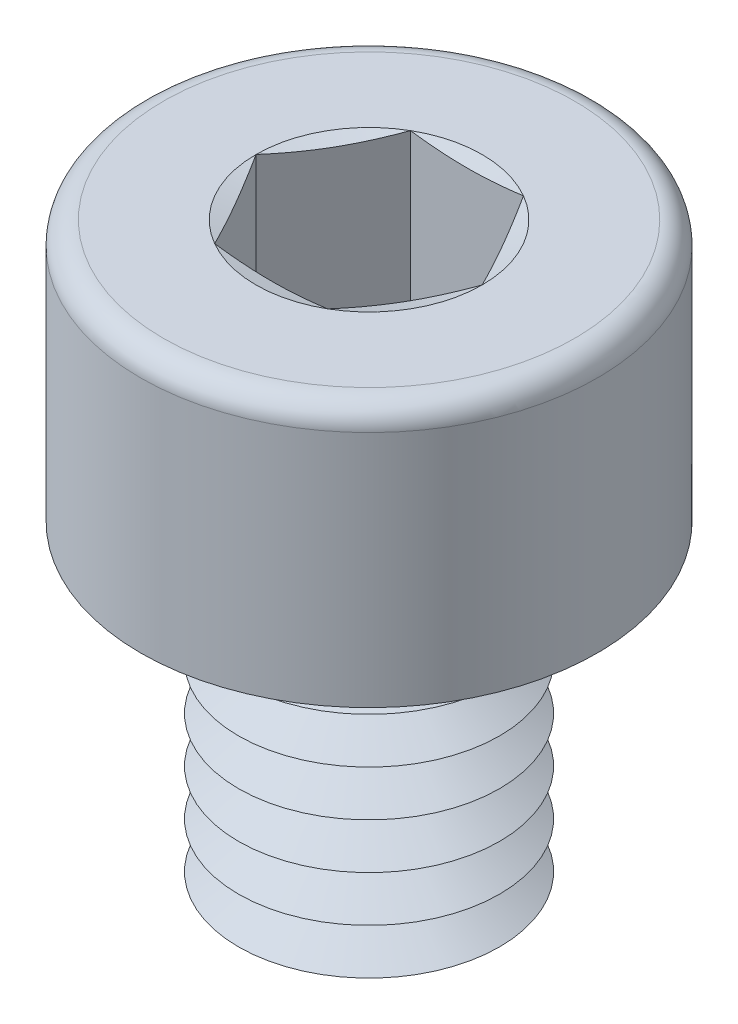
SolidWorks part; units mm, degrees
ref_plane "Front Plane" through (0, 0, 0) normal (0, 0, 1) x (1, 0, 0)
ref_plane "Top Plane" through (0, 0, 0) normal (0, 1, 0) x (1, 0, 0)
ref_plane "Right Plane" through (0, 0, 0) normal (1, 0, 0) x (0, 0, -1)
sketch "Sketch1" plane through (0, 0, 0) normal (0, 1, 0) x (1, 0, 0)
  circle A0 centre (0, 0) radius 2
  dimension "D1" = 4
extrude "Extrude1" add sketch "Sketch1" along normal blind 5
sketch "Sketch2" plane through (0, 5, 0) normal (0, 1, 0) x (1, 0, 0)
  circle A0 centre (0, 0) radius 3.5
  dimension "D1" = 7
extrude "Extrude2" add sketch "Sketch2" along normal blind 4
sketch "Sketch3" plane through (0, 9, 0) normal (0, 1, 0) x (1, 0, 0)
  line L1 (0.866, 1.5) -> (-0.866, 1.5)
  line L2 (-0.866, 1.5) -> (-1.7321, 0)
  line L3 (-1.7321, 0) -> (-0.866, -1.5)
  line L4 (-0.866, -1.5) -> (0.866, -1.5)
  line L5 (0.866, -1.5) -> (1.7321, 0)
  line L6 (1.7321, 0) -> (0.866, 1.5)
  circle A0 centre (0, 0) radius 1.5 construction
  dimension "D1" = 3
extrude "Extrude3" cut sketch "Sketch3" against normal blind 3
fillet "Fillet1" radius 0.35 1 edges at (0, 9, 3.5)
sketch "Sketch4" plane through (0, 0, 0) normal (1, 0, 0) x (0, 0, -1)
  line L0 (-1.5, 6) -> (0, 6)
  line L1 (0, 6) -> (0, 5.134)
  line L2 (0, 5.134) -> (-1.5, 6)
  dimension "D1" = 30
revolve "Cut-Revolve1" cut sketch "Sketch4" angle 360 about L1
sketch "Sketch5" plane through (0, 0, 0) normal (0, 0, 1) x (1, 0, 0)
  line L0 (-2, 0.35) -> (-2, -0.35)
  line L1 (-2, 5) -> (-2, 0) construction
  line L2 (-2, -0.35) -> (-1.3938, 0)
  line L3 (-2, 0) -> (2, 0) construction
  line L4 (-1.3938, 0) -> (-2, 0.35)
  dimension "D1" = 0.7
revolve "Cut-Revolve2" cut sketch "Sketch5" angle 360 about axis through (0, 5, 0) along (0, -1, 0)
pattern_linear "LPattern1" count 7 spacing 0.7 along (0, 1, 0) of "Cut-Revolve2"
sketch "Sketch6" plane through (0, 9, 0) normal (0, 1, 0) x (1, 0, 0)
  circle A0 centre (0, 0) radius 1.7321
extrude "Extrude4" cut sketch "Sketch6" against normal through all draft 75
